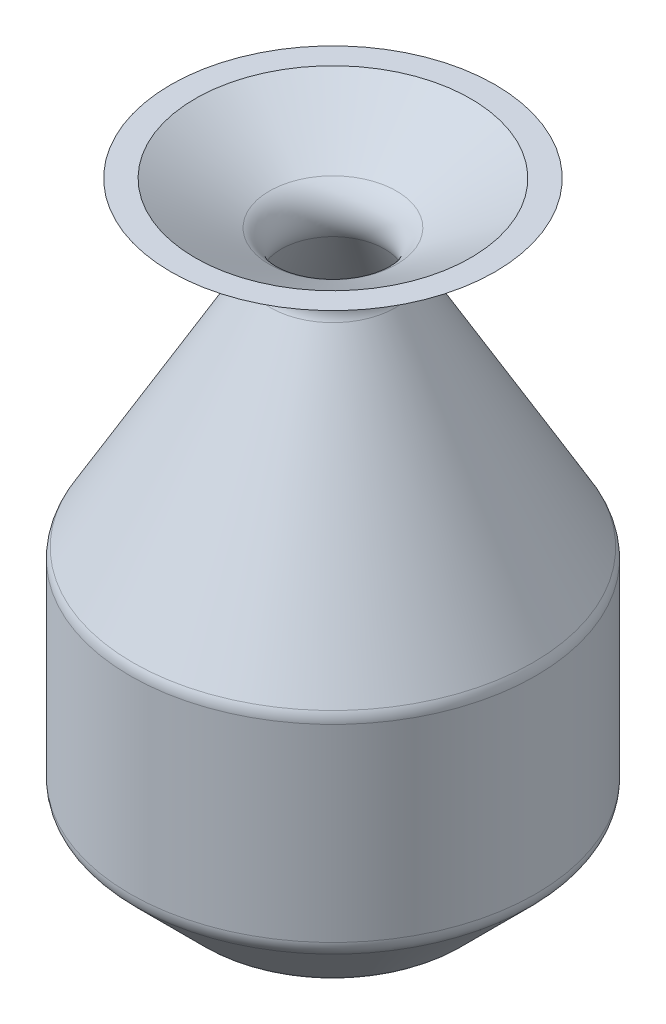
SolidWorks part; units mm, degrees
ref_plane "Piano frontale" through (0, 0, 0) normal (0, 0, 1) x (1, 0, 0)
ref_plane "Piano superiore" through (0, 0, 0) normal (0, 1, 0) x (1, 0, 0)
ref_plane "Piano destro" through (0, 0, 0) normal (1, 0, 0) x (0, 0, -1)
sketch "Schizzo1" plane through (0, 0, 0) normal (0, 0, 1) x (1, 0, 0)
  line L0 (0, 198.0253) -> (0, -62.7862) construction
  line L1 (0, 0) -> (-27.9289, 0)
  line L2 (-31.4645, 1.4645) -> (-48.5355, 18.5355)
  line L3 (-50, 22.0711) -> (-50, 68.6603)
  line L4 (-49.3301, 71.1603) -> (-15.359, 130)
  line L5 (-17.1891, 136.8301) -> (-40, 150)
  line L6 (-40, 150) -> (0, 150)
  line L7 (0, 150) -> (0, 0)
  arc A0 (-27.9289, 0) -> (-31.4645, 1.4645) centre (-27.9289, 5) cw
  arc A1 (-48.5355, 18.5355) -> (-50, 22.0711) centre (-45, 22.0711) cw
  arc A2 (-50, 68.6603) -> (-49.3301, 71.1603) centre (-45, 68.6603) cw
  arc A3 (-15.359, 130) -> (-17.1891, 136.8301) centre (-19.6891, 132.5) ccw
  point P12 (-30, 0)
  point P15 (-50, 20)
  point P18 (-50, 70)
  dimension "D8" = 5
  dimension "D1" = 60
  dimension "D2" = 135
  dimension "D3" = 100
  dimension "D4" = 150
  dimension "D5" = 30
  dimension "D6" = 50
  dimension "D7" = 80
revolve "Rivoluzione1" add sketch "Schizzo1" angle 360 about L0
shell "Svuota1" thickness 3
